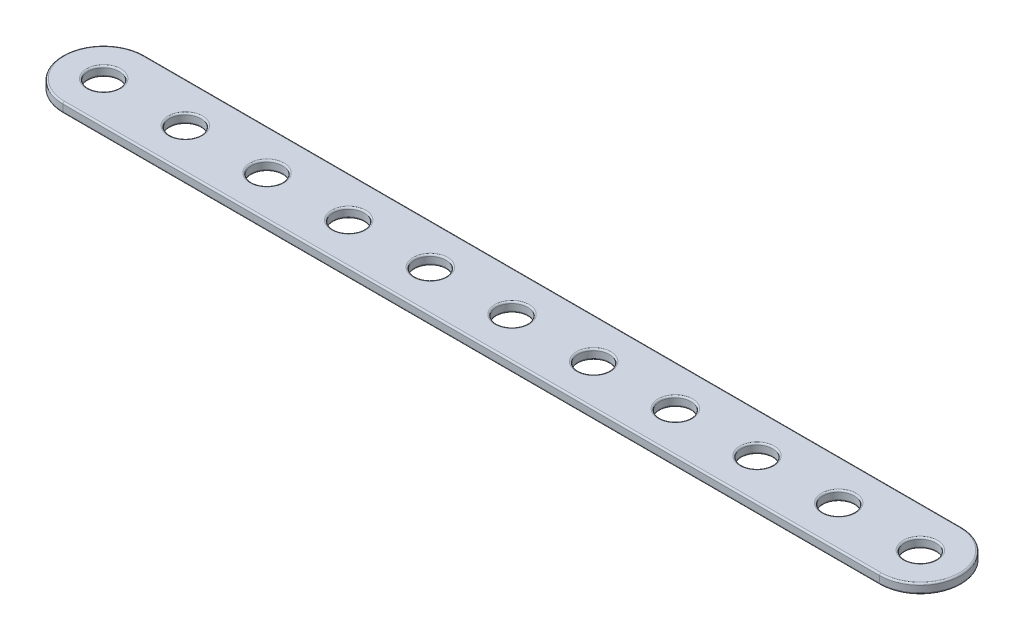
SolidWorks part; units mm, degrees
ref_plane "Front" through (0, 0, 0) normal (0, 0, 1) x (1, 0, 0)
ref_plane "Top" through (0, 0, 0) normal (0, 1, 0) x (1, 0, 0)
ref_plane "Right" through (0, 0, 0) normal (1, 0, 0) x (0, 0, -1)
sketch "Sketch1" plane through (0, 0, 0) normal (0, 1, 0) x (1, 0, 0)
  line L1 (0, 0) -> (127, 0)
  line L3 (0, 12.7) -> (127, 12.7)
  arc A0 (0, 12.7) -> (0, 0) centre (0, 6.35) ccw
  arc A1 (127, 0) -> (127, 12.7) centre (127, 6.35) ccw
  dimension "D1" = 12.7
  dimension "D2" = 127
extrude "Extrude1" add sketch "Sketch1" along normal blind 1.524
sketch "Sketch2" plane through (0, 1.524, 0) normal (0, 1, 0) x (-1, 0, 0)
  line L0 (-127, -12.7) -> (0, -12.7) construction
  circle A0 centre (0, -6.35) radius 2.413
  dimension "D2" = 4.826
  dimension "D1" = 6.35
extrude "Cut-Extrude1" cut sketch "Sketch2" against normal through all
pattern_linear "LPattern1" count 11 spacing 12.7 along (1, 0, 0) of "Cut-Extrude1"
fillet "Fillet1" radius 0.254 30 edges at (63.5, 0, 0) (133.35, 0, -6.35) (63.5, 0, -12.7) (-6.35, 0, -6.35) (0, 0, -3.937) (12.7, 0, -3.937) (25.4, 0, -3.937) (38.1, 0, -3.937) (50.8, 0, -3.937) (63.5, 0, -3.937) (76.2, 0, -3.937) (88.9, 0, -3.937) (101.6, 0, -3.937) (114.3, 0, -3.937) (127, 0, -3.937) (63.5, 1.524, -12.7) (133.35, 1.524, -6.35) (63.5, 1.524, 0) (-6.35, 1.524, -6.35) (0, 1.524, -3.937) (12.7, 1.524, -3.937) (25.4, 1.524, -3.937) (38.1, 1.524, -3.937) (50.8, 1.524, -3.937) (63.5, 1.524, -3.937) (76.2, 1.524, -3.937) (88.9, 1.524, -3.937) (101.6, 1.524, -3.937) (114.3, 1.524, -3.937) (127, 1.524, -3.937)
equation "\"D2@Sketch1\" = \"D3@LPattern1\" *  ( \"D1@LPattern1\" - 1 ) "
